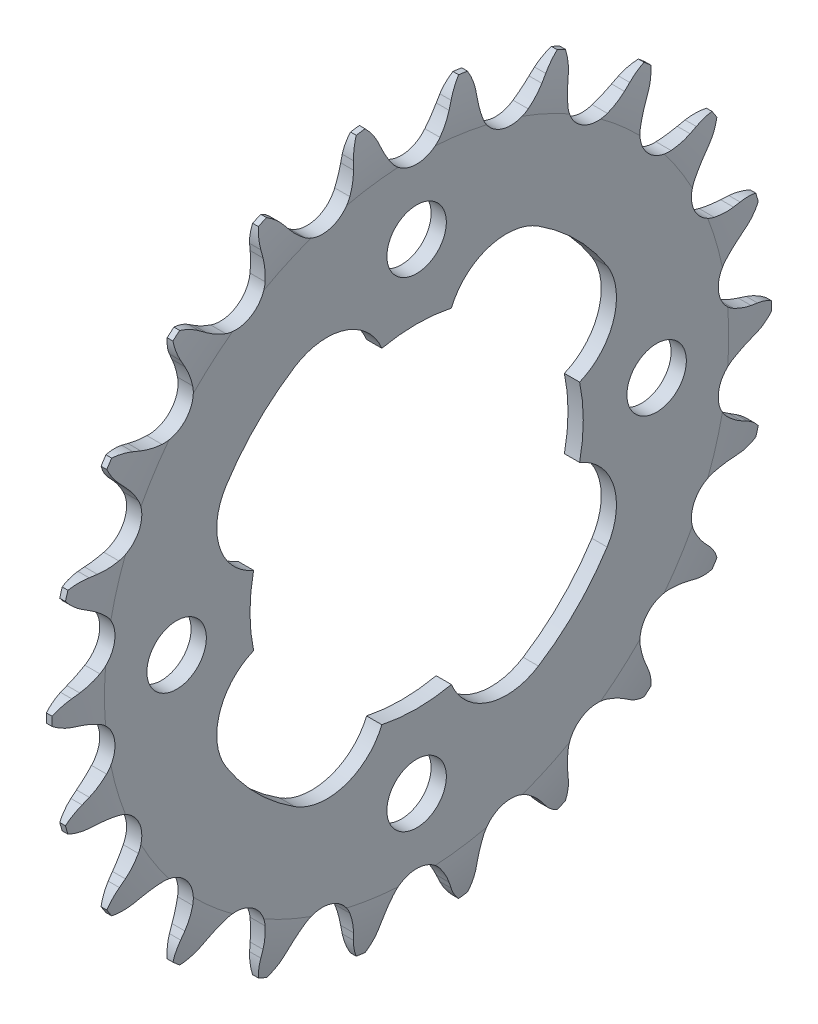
SolidWorks part; units mm, degrees
ref_plane "Plane1" through (0, 0, 0) normal (0, 0, 1) x (1, 0, 0)
ref_plane "Plane2" through (0, 0, 0) normal (0, 1, 0) x (1, 0, 0)
ref_plane "Plane3" through (0, 0, 0) normal (1, 0, 0) x (0, 0, -1)
sketch "BasProSke" plane through (0, 0, 0) normal (0, 1, 0) x (1, 0, 0)
  line L0 (-10, 0) -> (60, 0) construction
  line L1 (0, 0) -> (0, 41.6252)
  line L2 (0, 0) -> (2.032, 0)
  line L3 (2.032, 0) -> (2.032, 41.6252)
  line L4 (1.397, 47.9752) -> (0.635, 47.9752)
  arc A0 (0, 41.6252) -> (0.635, 47.9752) centre (32.0675, 41.6252) cw
  arc A1 (2.032, 41.6252) -> (1.397, 47.9752) centre (-30.0355, 41.6252) ccw
  dimension "D1" = 32.0675
  dimension "G1" = 0.635
  dimension "G2" = 0.635
  dimension "H2" = 6.35
  dimension "Diameter" = 95.9504
  dimension "H1" = 6.35
  dimension "Thickness" = 2.032
revolve "Base-Revolve" add sketch "BasProSke" angle 360 about L0
sketch "TooCutSke" plane through (0, 0, 0) normal (1, 0, 0) x (0, 0, -1)
  line L0 (4.4855, 44.5727) -> (4.8616, 45.491)
  line L1 (0, 0) -> (0, 107) construction
  line L2 (0, 44.6194) -> (-10, 44.6194) construction
  line L3 (-4.4855, 44.5727) -> (-4.8616, 45.491)
  arc A0 (3.1192, 42.2062) -> (4.4855, 44.5727) centre (-4.918, 48.4241) ccw
  arc A1 (3.1192, 42.2062) -> (-3.1192, 42.2062) centre (0, 44.6194) cw
  arc A2 (4.8616, 45.491) -> (10.7706, 49.4562) centre (10.7706, 43.0708) cw
  arc A3 (-3.1192, 42.2062) -> (-4.4855, 44.5727) centre (4.918, 48.4241) cw
  arc A4 (-4.8616, 45.491) -> (-10.7706, 49.4562) centre (-10.7706, 43.0708) ccw
  arc A5 (10.7706, 49.4562) -> (-10.7706, 49.4562) centre (0, 0) ccw
  dimension "R" = 3.9437
  dimension "E" = 10.1617
  dimension "F" = 6.3854
  dimension "Pitch_radius" = 44.6194
  dimension "W" = 10.7706
  dimension "V" = 1.5486
  dimension "A" = 37.727
  dimension "B" = 15.455
extrude "ToothCut" cut sketch "TooCutSke" along normal through all
pattern_circular "TeethCuts" count 22 every 16.364 about axis through (-10, 0, 0) along (1, 0, 0) of "ToothCut"
sketch "BorSke" plane through (0, 0, 0) normal (1, 0, 0) x (0, 0, -1)
  line L0 (0, 0) -> (21.3191, 21.3191) construction
  line L1 (0, 0) -> (0, 32.004) construction
  arc A0 (4.6409, 21.735) -> (21.735, 4.6409) centre (0, 0) ccw
  circle A1 centre (0, 32.004) radius 3.9624
  arc A2 (16.2407, 25.4018) -> (25.4018, 16.2407) centre (0, 0) cw
  arc A3 (4.6409, 21.735) -> (16.2407, 25.4018) centre (11.9718, 18.725) cw
  arc A4 (21.735, 4.6409) -> (25.4018, 16.2407) centre (18.725, 11.9718) ccw
  dimension "D1" = 44.45
  dimension "D3" = 7.9248
  dimension "D6" = 7.9248
  dimension "D2" = 32.004
  dimension "D4" = 45
  dimension "D5" = 4.7752
extrude "Bore" cut sketch "BorSke" along normal mid plane 101.6001
pattern_circular "CirPattern1" count 4 over 360 about axis through (0, 0, 0) along (1, 0, 0) of "Bore"
ref_plane "Plane4" through (1.016, 0, 0) normal (1, 0, 0) x (0, 0, -1)
sketch "Sketch2" plane through (1.016, 0, 0) normal (1, 0, 0) x (0, 0, -1)
  circle A0 centre (0, 0) radius 45.212
  dimension "D1" = 90.424
